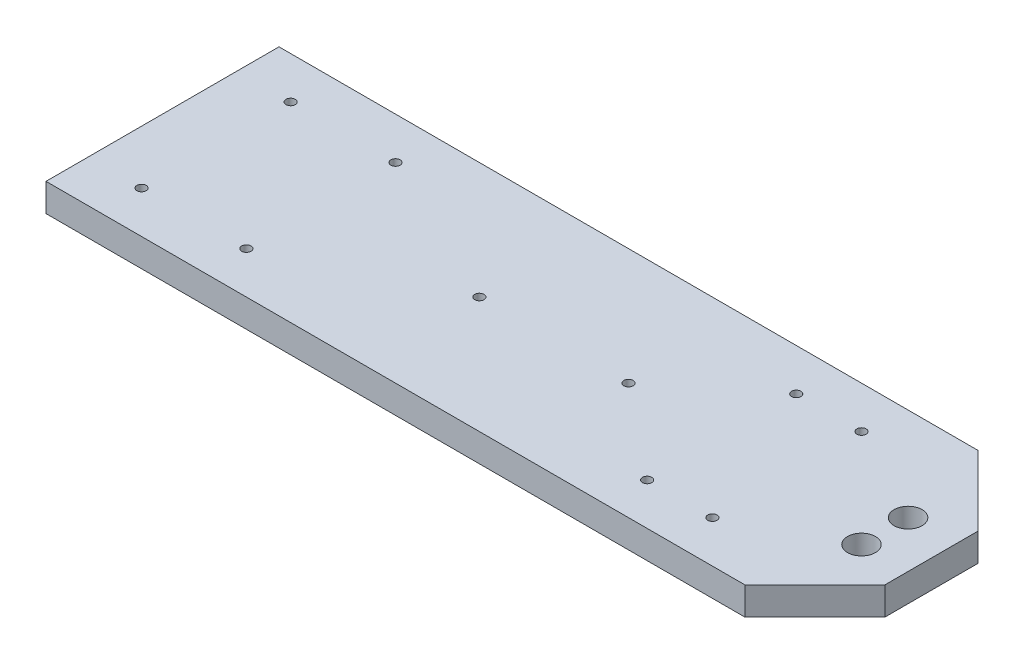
SolidWorks part; units mm, degrees
ref_plane "Face" through (0, 0, 0) normal (0, 0, 1) x (1, 0, 0)
ref_plane "Dessus" through (0, 0, 0) normal (0, 1, 0) x (1, 0, 0)
ref_plane "Droite" through (0, 0, 0) normal (1, 0, 0) x (0, 0, -1)
sketch "Esquisse1" plane through (0, 0, 0) normal (0, 1, 0) x (1, 0, 0)
  line L1 (0, 0) -> (165, 0)
  line L2 (0, 0) -> (0, 50)
  line L3 (0, 50) -> (165, 50)
  line L4 (165, 0) -> (165, 50)
  dimension "D1" = 165
  dimension "D2" = 50
extrude "Extrusion1" add sketch "Esquisse1" along normal blind 6
chamfer "Chanfrein1" distance 15 angle 45 2 edges at (165, 3, -50) (165, 3, 0)
sketch "Esquisse2" plane through (0, 6, 0) normal (0, 1, 0) x (-1, 0, 0)
  line L0 (-180.8333, -25) -> (24.881, -25) construction
  line L1 (0, -50) -> (0, 0) construction
  line L3 (-150, -50) -> (0, -50) construction
  line L4 (0, 0) -> (-150, 0) construction
  circle A0 centre (-134, -41) radius 1
  circle A1 centre (-120, -41) radius 1
  circle A2 centre (-34, -41) radius 1
  circle A3 centre (-11.5, -41) radius 1
  circle A4 centre (-11.5, -9) radius 1
  circle A5 centre (-34, -9) radius 1
  circle A6 centre (-120, -9) radius 1
  circle A7 centre (-134, -9) radius 1
  circle A8 centre (-100, -25) radius 1
  circle A9 centre (-68, -25) radius 1
  dimension "D6" = 2
  dimension "D7" = 68
  dimension "D1" = 9
  dimension "D2" = 11.5
  dimension "D3" = 34
  dimension "D4" = 120
  dimension "D5" = 134
  dimension "D8" = 100
extrude "Enlèv. mat.-Extru.1" cut sketch "Esquisse2" against normal through all
sketch "Esquisse3" plane through (0, 6, 0) normal (0, 1, 0) x (-1, 0, 0)
  line L0 (-169.6429, -25) -> (10.119, -25) construction
  line L1 (-150, -50) -> (0, -50) construction
  line L2 (0, 0) -> (-150, 0) construction
  line L3 (0, -50) -> (0, 0) construction
  circle A0 centre (-155, -30) radius 3
  circle A1 centre (-155, -20) radius 3
  dimension "D2" = 6
  dimension "D1" = 20
  dimension "D3" = 155
extrude "Enlèv. mat.-Extru.2" cut sketch "Esquisse3" against normal through all
